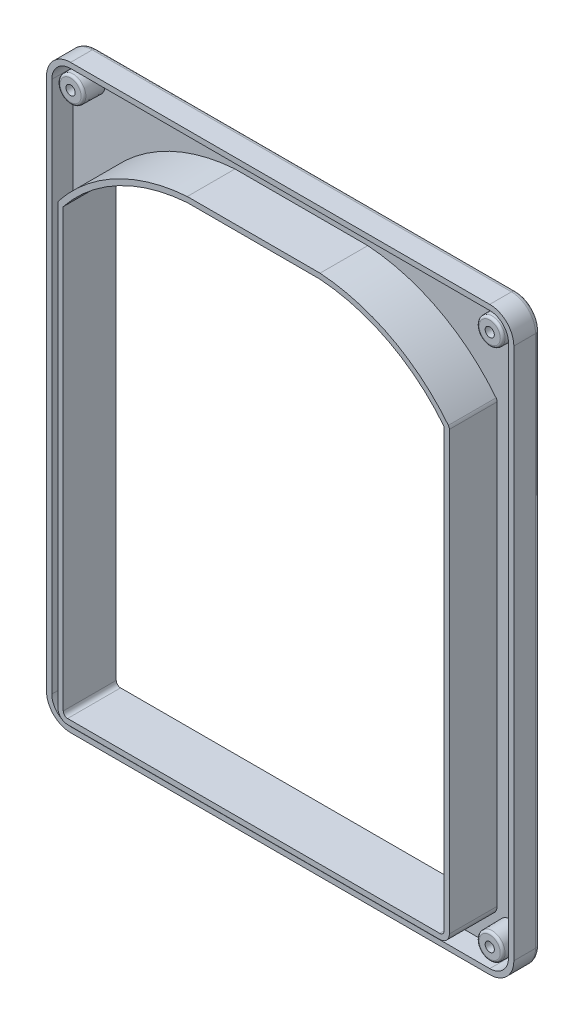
SolidWorks part; units mm, degrees
ref_plane "Face" through (0, 0, 0) normal (0, 0, 1) x (1, 0, 0)
ref_plane "Dessus" through (0, 0, 0) normal (0, 1, 0) x (1, 0, 0)
ref_plane "Droite" through (0, 0, 0) normal (1, 0, 0) x (0, 0, -1)
sketch "Esquisse1" plane through (0, 0, 0) normal (0, 0, 1) x (1, 0, 0)
  line L0 (0, 0) -> (39.8094, 0) construction
  line L1 (-77.25, -107.35) -> (77.25, -107.35)
  line L2 (-81.25, -103.35) -> (-81.25, 78.0298)
  line L3 (-27.5614, 107.35) -> (27.5614, 107.35)
  line L4 (81.25, -103.35) -> (81.25, 78.0298)
  line L5 (0, 0) -> (0, 53.9116) construction
  line L6 (-77.25, -105.15) -> (77.25, -105.15)
  line L7 (79.05, -103.35) -> (79.05, 77.9601)
  line L8 (-27.4841, 105.15) -> (27.4841, 105.15)
  line L9 (-79.05, -103.35) -> (-79.05, 77.9601)
  arc A0 (-80.8174, 79.2721) -> (-27.5614, 107.35) centre (-22.3628, 32.9449) cw
  arc A1 (80.8174, 79.2721) -> (27.5614, 107.35) centre (22.3628, 32.9449) ccw
  arc A2 (-81.25, 78.0298) -> (-80.8174, 79.2721) centre (-79.25, 78.0298) cw
  arc A3 (81.25, 78.0298) -> (80.8174, 79.2721) centre (79.25, 78.0298) ccw
  arc A4 (81.25, -103.35) -> (77.25, -107.35) centre (77.25, -103.35) cw
  arc A5 (-81.25, -103.35) -> (-77.25, -107.35) centre (-77.25, -103.35) ccw
  arc A6 (79.05, -103.35) -> (77.25, -105.15) centre (77.25, -103.35) cw
  arc A7 (79.05, 77.9601) -> (79.05, 77.9601) centre (79.05, 77.9601) ccw
  arc A8 (79.05, 77.9601) -> (27.4841, 105.15) centre (22.3628, 32.9449) ccw
  arc A9 (-79.05, 77.9601) -> (-27.4841, 105.15) centre (-22.3628, 32.9449) cw
  arc A10 (-79.05, 77.9601) -> (-79.05, 77.9601) centre (-79.05, 77.9601) cw
  arc A11 (-79.05, -103.35) -> (-77.25, -105.15) centre (-77.25, -103.35) ccw
  point P7 (-81.25, 78.721)
  point P16 (81.25, 78.721)
  point P19 (81.25, -107.35)
  point P22 (-81.25, -107.35)
  dimension "D1" = 2
  dimension "D3" = 4
  dimension "D2" = 162.5
  dimension "D4" = 2.2
extrude "Extrusion1" add sketch "Esquisse1" along normal blind 22
sketch "Esquisse2" plane through (0, 0, 0) normal (0, 0, 1) x (1, 0, 0)
  line L0 (0, 0) -> (0, -42.3636) construction
  line L1 (-87, 120.35) -> (87, 120.35)
  line L2 (-97, 110.35) -> (-97, -110.65)
  line L3 (-87, -120.65) -> (87, -120.65)
  line L4 (97, 110.35) -> (97, -110.65)
  line L5 (-77.25, -105.15) -> (77.25, -105.15) construction
  line L6 (79.05, -103.35) -> (79.05, 77.9601) construction
  line L7 (-79.05, 77.9601) -> (-79.05, -103.35) construction
  line L8 (27.4841, 105.15) -> (-27.4841, 105.15) construction
  line L9 (-77.25, -105.15) -> (77.25, -105.15)
  line L10 (79.05, -103.35) -> (79.05, 77.9601)
  line L11 (-79.05, 77.9601) -> (-79.05, -103.35)
  line L12 (27.4841, 105.15) -> (-27.4841, 105.15)
  circle A0 centre (87, 110.35) radius 3.5 construction
  circle A1 centre (-87, 110.35) radius 3.5 construction
  circle A2 centre (-87, -110.65) radius 3.5 construction
  circle A3 centre (87, -110.65) radius 3.5 construction
  arc A4 (87, -120.65) -> (97, -110.65) centre (87, -110.65) ccw
  arc A5 (-97, -110.65) -> (-87, -120.65) centre (-87, -110.65) ccw
  arc A6 (-87, 120.35) -> (-97, 110.35) centre (-87, 110.35) ccw
  arc A7 (87, 120.35) -> (97, 110.35) centre (87, 110.35) cw
  circle A8 centre (87, 110.35) radius 1.75
  circle A9 centre (87, -110.65) radius 1.75
  circle A10 centre (-87, 110.35) radius 1.75
  circle A11 centre (-87, -110.65) radius 1.75
  arc A12 (-27.4841, 105.15) -> (-79.05, 77.9601) centre (-22.3628, 32.9449) ccw construction
  arc A13 (79.05, 77.9601) -> (27.4841, 105.15) centre (22.3628, 32.9449) ccw construction
  arc A14 (-27.4841, 105.15) -> (-79.05, 77.9601) centre (-22.3628, 32.9449) ccw
  arc A15 (79.05, 77.9601) -> (27.4841, 105.15) centre (22.3628, 32.9449) ccw
  arc A16 (-79.05, -103.35) -> (-77.25, -105.15) centre (-77.25, -103.35) ccw construction
  arc A17 (-79.05, -103.35) -> (-77.25, -105.15) centre (-77.25, -103.35) ccw
  arc A18 (77.25, -105.15) -> (79.05, -103.35) centre (77.25, -103.35) ccw construction
  arc A19 (77.25, -105.15) -> (79.05, -103.35) centre (77.25, -103.35) ccw
  point P6 (0, -120.65)
  point P19 (97, -120.65)
  point P24 (-97, 120.35)
  point P27 (97, 120.35)
  dimension "D4" = 7
  dimension "D5" = 10
  dimension "D7" = 10
  dimension "D9" = 10
  dimension "D10" = 3.5
  dimension "D11" = 3.5
  dimension "D12" = 3.5
  dimension "D1" = 194
  dimension "D2" = 241
  dimension "D3" = 15.5
  dimension "D6" = 10
  dimension "D8" = 10
extrude "Extrusion2" add sketch "Esquisse2" along normal blind 2.2
sketch "Esquisse3" plane through (0, 0, 2.2) normal (0, 0, 1) x (1, 0, 0)
  line L4 (97, -110.65) -> (97, 110.35)
  line L5 (87, 120.35) -> (-87, 120.35)
  line L6 (-97, 110.35) -> (-97, -110.65)
  line L7 (-87, -120.65) -> (87, -120.65)
  line L8 (97, -110.65) -> (97, 110.35)
  line L9 (87, 120.35) -> (-87, 120.35)
  line L10 (-97, 110.35) -> (-97, -110.65)
  line L11 (-87, -120.65) -> (87, -120.65)
  arc A4 (87, -120.65) -> (97, -110.65) centre (87, -110.65) ccw
  arc A5 (97, 110.35) -> (87, 120.35) centre (87, 110.35) ccw
  arc A6 (-87, 120.35) -> (-97, 110.35) centre (-87, 110.35) ccw
  arc A7 (-97, -110.65) -> (-87, -120.65) centre (-87, -110.65) ccw
  arc A8 (87, -120.65) -> (97, -110.65) centre (87, -110.65) ccw
  arc A9 (97, 110.35) -> (87, 120.35) centre (87, 110.35) ccw
  arc A10 (-87, 120.35) -> (-97, 110.35) centre (-87, 110.35) ccw
  arc A11 (-97, -110.65) -> (-87, -120.65) centre (-87, -110.65) ccw
  dimension "D1" = 0
extrude "Extru.-Mince1" add sketch "Esquisse3" along normal blind 8.8 thin
fillet "Congé1" radius 2 8 edges at (94.0711, -117.7211, 0) (97, -0.15, 0) (94.0711, 117.4211, 0) (0, 120.35, 0) (-94.0711, 117.4211, 0) (-97, -0.15, 0) (-94.0711, -117.7211, 0) (0, -120.65, 0)
sketch "Esquisse4" plane through (0, 0, 2.2) normal (0, 0, 1) x (1, 0, 0)
  circle A0 centre (87, 110.35) radius 1.75 construction
  circle A1 centre (87, 110.35) radius 1.75
  circle A2 centre (87, 110.35) radius 5.5
  circle A3 centre (-87, 110.35) radius 5.5
  circle A4 centre (-87, 110.35) radius 1.75 construction
  circle A5 centre (-87, -110.65) radius 5.5
  circle A6 centre (-87, -110.65) radius 1.75 construction
  circle A7 centre (87, -110.65) radius 5.5
  circle A8 centre (87, -110.65) radius 1.75 construction
  circle A9 centre (87, -110.65) radius 1.75
  circle A10 centre (-87, -110.65) radius 1.75
  circle A11 centre (-87, 110.35) radius 1.75
  dimension "D1" = 11
extrude "Extrusion3" add sketch "Esquisse4" along normal up to surface (8.8 mm away) draft 1
fillet "Congé2" radius 1 4 edges at (92.3464, 110.35, 11) (-81.6536, 110.35, 11) (-81.6536, -110.65, 11) (92.3464, -110.65, 11)
sketch "Esquisse5" plane through (0, 0, 0) normal (0, 0, -1) x (-1, 0, 0)
  circle A0 centre (87, -110.65) radius 1.75 construction
  circle A1 centre (-87, -110.65) radius 1.75 construction
  circle A2 centre (-87, 110.35) radius 1.75 construction
  circle A3 centre (87, 110.35) radius 1.75 construction
  circle A4 centre (87, -110.65) radius 1.75
  circle A5 centre (-87, -110.65) radius 1.75
  circle A6 centre (-87, 110.35) radius 1.75
  circle A7 centre (87, 110.35) radius 1.75
  circle A8 centre (87, 110.35) radius 3.675
  circle A9 centre (-87, 110.35) radius 3.675
  circle A10 centre (-87, -110.65) radius 3.675
  circle A11 centre (87, -110.65) radius 3.675
  dimension "D1" = 7.35
extrude "Enlèv. mat.-Extru.1" cut sketch "Esquisse5" against normal offset from surface 2.2 draft 1
fillet "Congé3" radius 0.5 4 edges at (-90.675, 110.35, 0) (83.325, 110.35, 0) (83.325, -110.65, 0) (-90.675, -110.65, 0)
